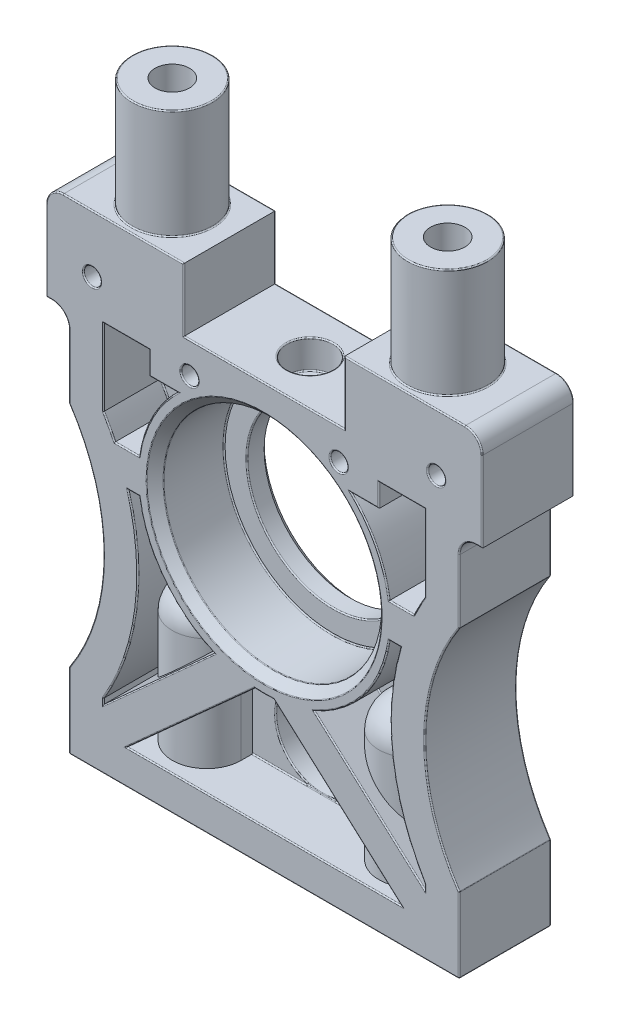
SolidWorks part; units mm, degrees
ref_plane "Plan1" through (0, 0, 0) normal (0, 0, 1) x (1, 0, 0)
ref_plane "Plan2" through (0, 0, 0) normal (0, 1, 0) x (1, 0, 0)
ref_plane "Plan3" through (0, 0, 0) normal (1, 0, 0) x (0, 0, -1)
sketch "Esquisse1" plane through (0, 0, 0) normal (0, 0, 1) x (1, 0, 0)
  line L0 (0, 0) -> (0, 36.8611) construction
  line L1 (-17.5, 18) -> (-7, 18)
  line L2 (-19, 16.5) -> (-19, 9.5)
  line L3 (-17, -24) -> (17, -24)
  line L4 (0, 0) -> (0, -28.7614) construction
  line L5 (-7, 18) -> (-7, 12.5)
  line L6 (-7, 12.5) -> (7, 12.5)
  line L7 (7, 18) -> (7, 12.5)
  line L8 (7, 18) -> (17.5, 18)
  line L9 (-19, 9.5) -> (-18.5, 9.5)
  line L10 (-17, 8) -> (-17, 2.4499)
  line L11 (-32, -7.5) -> (0, -7.5) construction
  line L12 (-17, -17.4499) -> (-17, -24)
  line L13 (17, -17.4499) -> (17, -24)
  line L14 (17, 8) -> (17, 2.4499)
  line L15 (19, 9.5) -> (18.5, 9.5)
  line L16 (19, 16.5) -> (19, 9.5)
  arc A0 (-17, -17.4499) -> (-17, 2.4499) centre (-32, -7.5) ccw
  arc A1 (17, -17.4499) -> (17, 2.4499) centre (32, -7.5) cw
  circle A2 centre (0, 0) radius 7.5
  circle A3 centre (0, -17) radius 4
  arc A4 (-17, 8) -> (-18.5, 9.5) centre (-18.5, 8) ccw
  arc A5 (17, 8) -> (18.5, 9.5) centre (18.5, 8) cw
  arc A6 (17.5, 18) -> (19, 16.5) centre (17.5, 16.5) cw
  arc A7 (-19, 16.5) -> (-17.5, 18) centre (-17.5, 16.5) cw
  point P10 (0, 12.5)
  point P16 (0, -24)
  point P29 (-17, 9.5)
  point P32 (17, 9.5)
  point P35 (19, 18)
  point P38 (-19, 18)
  dimension "D10" = 36
  dimension "D11" = 15
  dimension "D12" = 8
  dimension "D14" = 1.5
  dimension "D1" = 12.5
  dimension "D2" = 7.5
  dimension "D3" = 19
  dimension "D4" = 24
  dimension "D5" = 7
  dimension "D6" = 5.5
  dimension "D7" = 17
  dimension "D8" = 9.5
  dimension "D9" = 32
  dimension "D13" = 17
extrude "Extrusion1" add sketch "Esquisse1" along normal mid plane 8
sketch "Esquisse2" plane through (0, 0, 4) normal (0, 0, 1) x (1, 0, 0)
  line L0 (-10, 8) -> (-7.5498, 8)
  line L1 (7.5498, 8) -> (10, 8)
  line L2 (14, 3.3167) -> (14, 10)
  line L3 (-14, 3.3167) -> (-14, 10)
  line L4 (-14, 10) -> (-10, 10)
  line L5 (10, 10) -> (14, 10)
  line L28 (-10, 9.5) -> (-10, 15)
  line L29 (-10, 15) -> (-16, 15)
  line L30 (-16, 15) -> (-16, 11.7417)
  line L31 (-14, 8) -> (-14, 3.3167)
  line L32 (-14, -18.3167) -> (-14, -21)
  line L33 (-14, -21) -> (14, -21)
  line L34 (14, -21) -> (14, -18.3167)
  line L35 (14, 3.3167) -> (14, 8)
  line L36 (16, 11.7417) -> (16, 15)
  line L37 (16, 15) -> (10, 15)
  line L38 (10, 15) -> (10, 9.5)
  line L39 (10, 9.5) -> (-10, 9.5)
  line L40 (-10, 8) -> (-10, 10)
  line L44 (-14, -18.3167) -> (-14, -21)
  line L45 (-14, -21) -> (14, -21)
  line L46 (14, -21) -> (14, -18.3167)
  line L50 (10, 10) -> (10, 8)
  circle A0 centre (0, 0) radius 7.5 construction
  circle A1 centre (0, 0) radius 7.5
  arc A2 (-7.5498, 8) -> (7.5498, 8) centre (0, 0) ccw
  arc A12 (-14, 8) -> (-16, 11.7417) centre (-18.5, 8) ccw
  arc A13 (-14, -18.3167) -> (-14, 3.3167) centre (-32, -7.5) ccw
  arc A14 (14, 3.3167) -> (14, -18.3167) centre (32, -7.5) ccw
  arc A15 (16, 11.7417) -> (14, 8) centre (18.5, 8) ccw
  arc A17 (-14, -18.3167) -> (-14, 3.3167) centre (-32, -7.5) ccw
  arc A18 (14, 3.3167) -> (14, -18.3167) centre (32, -7.5) ccw
  dimension "D2" = 3.5
  dimension "D3" = 8
  dimension "D4" = 10
  dimension "D1" = 3
extrude "Enlèv. mat.-Extru.1" cut sketch "Esquisse2" against normal blind 5
sketch "Esquisse3" plane through (0, 0, 4) normal (0, 0, 1) x (1, 0, 0)
  circle A0 centre (0, 0) radius 9.5
  dimension "D1" = 19
extrude "Enlèv. mat.-Extru.2" cut sketch "Esquisse3" against normal blind 6
chamfer "Chanfrein1" distance 0.75 angle 45
sketch "Esquisse5" plane through (0, 0, 4) normal (0, 0, 1) x (1, 0, 0)
  line L0 (0, 0) -> (0, -28.1163) construction
  line L1 (-16.2603, -20.8299) -> (-4.3481, -10.1042)
  line L2 (-0.8252, -10.969) -> (-14.4018, -23.1935)
  line L3 (-16.2603, -20.8299) -> (-14.4018, -23.1935)
  line L4 (0, 0) -> (-21.9896, 0) construction
  line L5 (-13.0263, 1.5) -> (-10.8972, 1.5)
  line L6 (-11.8754, -1.5) -> (-10.8972, -1.5)
  arc A0 (-4.3481, -10.1042) -> (-0.8252, -10.969) centre (0, 0) ccw
  arc A1 (-10.8972, 1.5) -> (-10.8972, -1.5) centre (0, 0) ccw
  arc A2 (-11.8754, -1.5) -> (-13.0263, 1.5) centre (-32, -7.5) ccw
  arc A3 (-14, -18.3167) -> (-14, 3.3167) centre (-32, -7.5) ccw construction
  arc A4 (-7.5498, 8) -> (7.5498, 8) centre (0, 0) ccw construction
  dimension "D2" = 3
  dimension "D3" = 48
  dimension "D4" = 1.5
  dimension "D5" = 1.5
extrude "Extrusion4" add sketch "Esquisse5" against normal up to surface (5 mm away)
mirror "Symétrie1" about plane through (0, 0, 0) normal (1, 0, 0)
chamfer "Chanfrein2" distance 0.5 angle 45
fillet "Congé2" radius 0.1
sketch "Esquisse6" plane through (0, 0, 0) normal (0, 0, 1) x (1, 0, 0)
  line L0 (-12, -23.9) -> (-12, -11.1975)
  line L1 (-9, -26.5752) -> (-9, -10.6629) construction
  line L2 (-16.9, -23.9) -> (16.9, -23.9) construction
  line L3 (-12, -23.9) -> (-9, -23.9)
  line L4 (-9, -23.9) -> (-9, -8.1975)
  arc A0 (-9, -8.1975) -> (-12, -11.1975) centre (-9, -11.1975) ccw
  dimension "D1" = 9
  dimension "D2" = 3
revolve "Révolution1" add sketch "Esquisse6" angle 180 about L1
sketch "Esquisse8" plane through (0, 0, 0) normal (0, 0, 1) x (1, 0, 0)
  line L0 (-12, -23.9) -> (-12, -11.1975)
  line L1 (-9, -26.5752) -> (-9, -10.6629) construction
  line L3 (-12, -23.9) -> (-6, -23.9)
  line L4 (-6, -23.9) -> (-6, -11.1975)
  arc A0 (-6, -11.1975) -> (-12, -11.1975) centre (-9, -11.1975) ccw
  point P5 (-9, -23.9)
  dimension "D2" = 3
extrude "Extrusion5" add sketch "Esquisse8" against normal up to surface (1 mm away)
mirror "Symétrie2" about plane through (0, 0, 0) normal (1, 0, 0)
hole_wizard "Trou taraudé M4x0.71" positions "Esquisse3D1" profile "Esquisse11" tap size "M4x0.7" standard "ISO"
sketch3d "Esquisse3D1"
  point P0 (9, -24, 0)
  point P1 (-9, -24, 0)
sketch "Esquisse11" plane through (9, -24, 0) normal (1, 0, 0) x (0, 0, -1)
  line L0 (0, 0) -> (0, 12.4914)
  line L1 (0, 12.4914) -> (1.65, 11.5)
  line L2 (1.65, 11.5) -> (1.65, 8)
  line L3 (1.65, 8) -> (2, 8)
  line L4 (2, 8) -> (2, 0)
  line L5 (2, 0) -> (0, 0)
  line L10 (0, 12.4914) -> (-1.65, 11.5) construction
  line L11 (0, -6.35) -> (0, 107.95) construction
  dimension "Diamètre du trou pour taraudage" = 3.3
  dimension "Profondeur du trou pour taraudage" = 11.5
  dimension "Diamètre principal du filetage" = 4
  dimension "Profondeur du filetage" = 8
  dimension "Angle de pointe" = 118
sketch "Esquisse12" plane through (0, 18, 0) normal (0, 1, 0) x (-1, 0, 0)
  line L0 (0, 0) -> (0, -13.3178) construction
  circle A0 centre (-12, 0) radius 3.5
  circle A1 centre (12, 0) radius 3.5
  dimension "D1" = 7
  dimension "D2" = 12
extrude "Extrusion6" add sketch "Esquisse12" along normal blind 9.5
sketch "Esquisse13" plane through (0, 12.5, 0) normal (0, 1, 0) x (-1, 0, 0)
  circle A0 centre (0, 0) radius 2
  dimension "D1" = 4
extrude "Enlèv. mat.-Extru.3" cut sketch "Esquisse13" against normal blind 2.5
sketch "Esquisse14" plane through (0, 0, -4) normal (0, 0, -1) x (-1, 0, 0)
  line L0 (0, 0) -> (0, 26.6708) construction
  circle A0 centre (-15, 13) radius 0.75
  circle A1 centre (15, 13) radius 0.75
  dimension "D1" = 1.5
  dimension "D2" = 15
  dimension "D3" = 13
extrude "Enlèv. mat.-Extru.4" cut sketch "Esquisse14" against normal through all
sketch "Esquisse15" plane through (0, 0, 4) normal (0, 0, 1) x (1, 0, 0)
  line L0 (0, 0) -> (0, 23.2145) construction
  circle A0 centre (-6.5, 9.765) radius 0.75
  circle A1 centre (6.5, 9.765) radius 0.75
  dimension "D1" = 1.5
  dimension "D2" = 6.5
extrude "Enlèv. mat.-Extru.5" cut sketch "Esquisse15" against normal blind 2.5
fillet "Congé3" radius 0.1
hole_wizard "Trou taraudé M3x0.51" positions "Esquisse19" profile "Esquisse18" tap size "M3x0.5" standard "ISO"
sketch "Esquisse19" plane through (0, 27.5, 0) normal (0, 1, 0) x (-1, 0, 0)
  circle A2 centre (12, 0) radius 3.4 construction
  circle A3 centre (-12, 0) radius 3.4 construction
  point P0 (12, 0)
  point P1 (-12, 0)
sketch "Esquisse18" plane through (-12, 27.5, 0) normal (1, 0, 0) x (0, 0, 1)
  line L0 (0, 0) -> (0, 9.2511)
  line L1 (0, 9.2511) -> (1.25, 8.5)
  line L2 (1.25, 8.5) -> (1.25, 6)
  line L3 (1.25, 6) -> (1.5, 6)
  line L4 (1.5, 6) -> (1.5, 0)
  line L5 (1.5, 0) -> (0, 0)
  line L10 (0, 9.2511) -> (-1.25, 8.5) construction
  line L11 (0, -6.35) -> (0, 107.95) construction
  dimension "Diamètre du trou pour taraudage" = 2.5
  dimension "Profondeur du trou pour taraudage" = 8.5
  dimension "Diamètre principal du filetage" = 3
  dimension "Profondeur du filetage" = 6
  dimension "Angle de pointe" = 118
